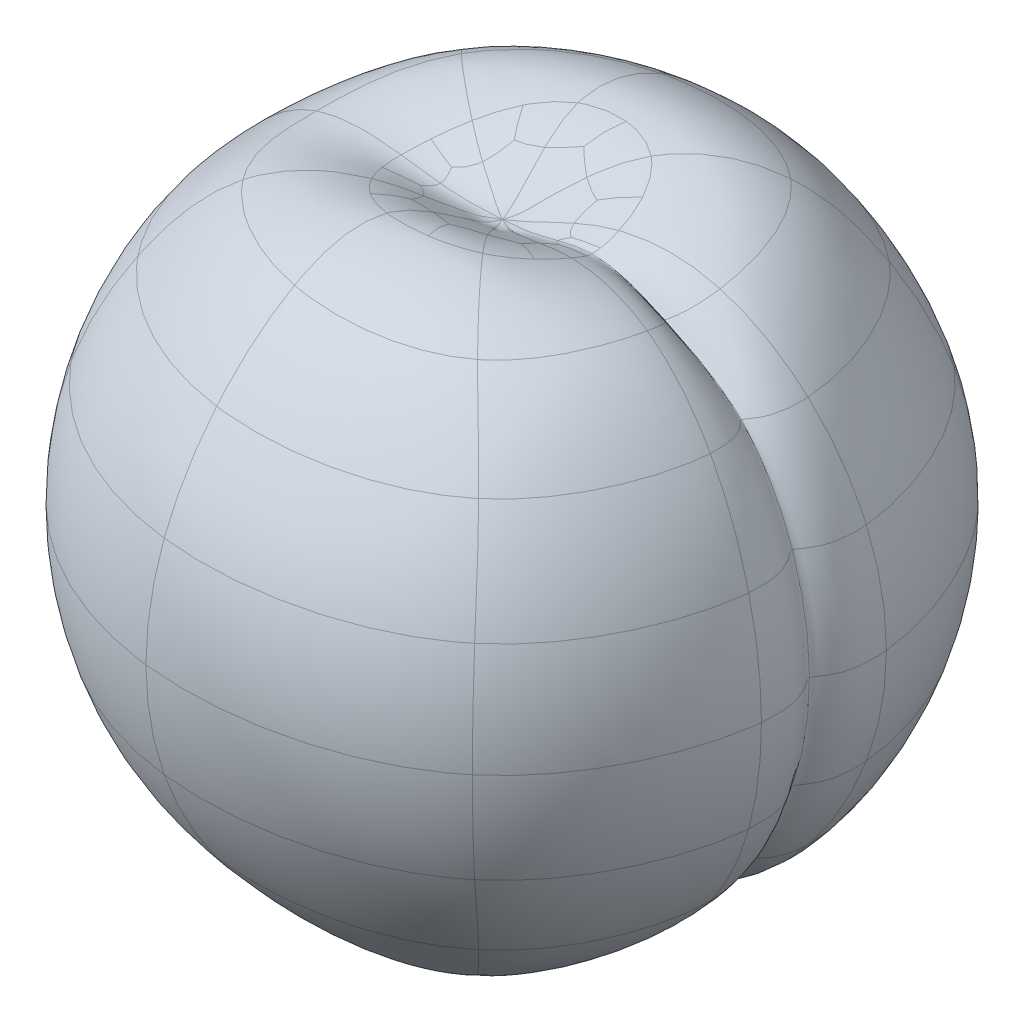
SolidWorks part; units mm, degrees
ref_plane "Front Plane" through (0, 0, 0) normal (0, 0, 1) x (1, 0, 0)
ref_plane "Top Plane" through (0, 0, 0) normal (0, 1, 0) x (1, 0, 0)
ref_plane "Right Plane" through (0, 0, 0) normal (1, 0, 0) x (0, 0, -1)
imported_body "Peach Test.step<1>"
move or copy body "Body-Move/Copy1" bodies to move or copy 101 copy no rotation origin (0, 0, 0) rotation axis (-1, 0, 0) rotation angle 90
scale "Scale1" bodies to scale 102 scale about origin uniform scaling yes scale factor 0.5
